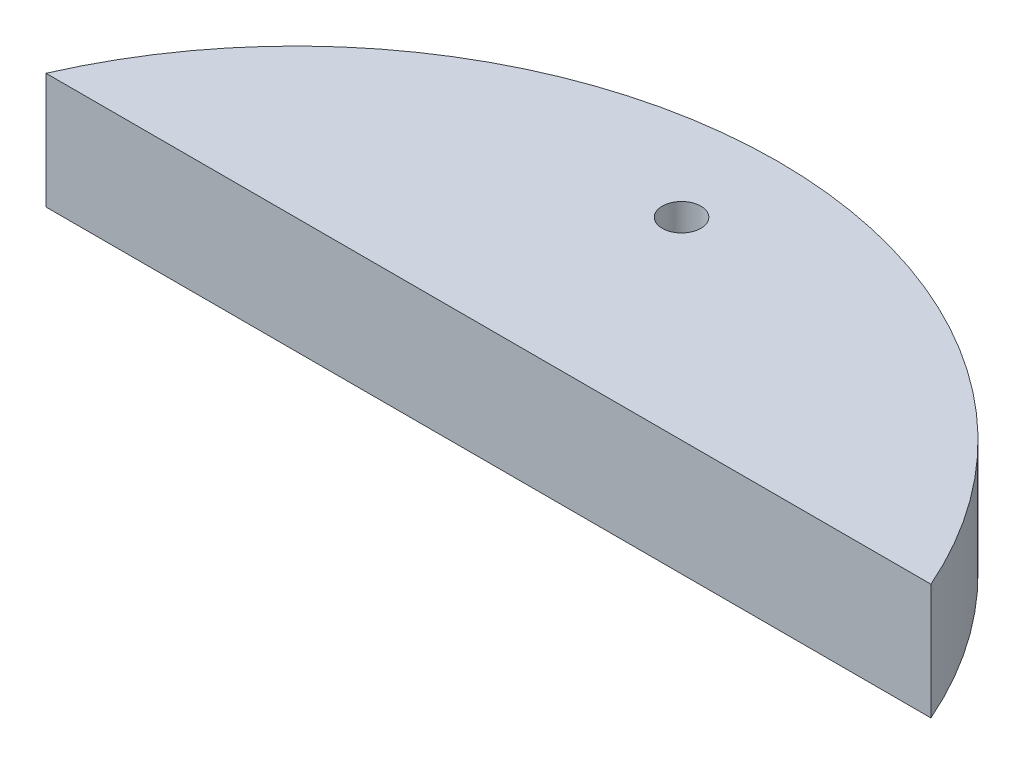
SolidWorks part; units mm, degrees
ref_plane "Front Plane" through (0, 0, 0) normal (0, 0, 1) x (1, 0, 0)
ref_plane "Top Plane" through (0, 0, 0) normal (0, 1, 0) x (1, 0, 0)
ref_plane "Right Plane" through (0, 0, 0) normal (1, 0, 0) x (0, 0, -1)
sketch "Sketch1" plane through (0, 0, 0) normal (0, 1, 0) x (1, 0, 0)
  line L0 (0, 0) -> (0, 10) construction
  circle A0 centre (0, 0) radius 12.5
  circle A1 centre (0, 0) radius 1.75
  circle A2 centre (0, 10) radius 0.5
  dimension "D1" = 25
  dimension "D2" = 3.5
  dimension "D3" = 1
  dimension "D4" = 10
extrude "Boss-Extrude1" add sketch "Sketch1" along normal blind 3
sketch "Sketch2" plane through (0, 0, 0) normal (0, 1, 0) x (1, 0, 0)
  line L0 (-12.5, 0) -> (12.5, 0) construction
  line L1 (0, 0) -> (0, -21.8157) construction
  line L2 (-12.5, 5) -> (12.5, 5)
  line L3 (-12.5, 5) -> (12.5, 5) construction
  line L4 (-12.5, 5) -> (-12.5, -5) construction
  line L5 (-12.5, -5) -> (12.5, -5) construction
  line L6 (12.5, 5) -> (12.5, -5) construction
  line L7 (-12.5, 5) -> (12.5, -5) construction
  line L8 (-12.5, -5) -> (12.5, 5) construction
  line L9 (-12.5, 5) -> (-12.5, -19.0441)
  line L10 (12.5, 5) -> (12.5, -19.0441)
  line L11 (-12.5, -19.0441) -> (12.5, -19.0441)
  circle A0 centre (0, 0) radius 12.5 construction
  point P12 (11.4564, 5)
  dimension "D1" = 10
extrude "Cut-Extrude1" cut sketch "Sketch2" along normal blind 10
